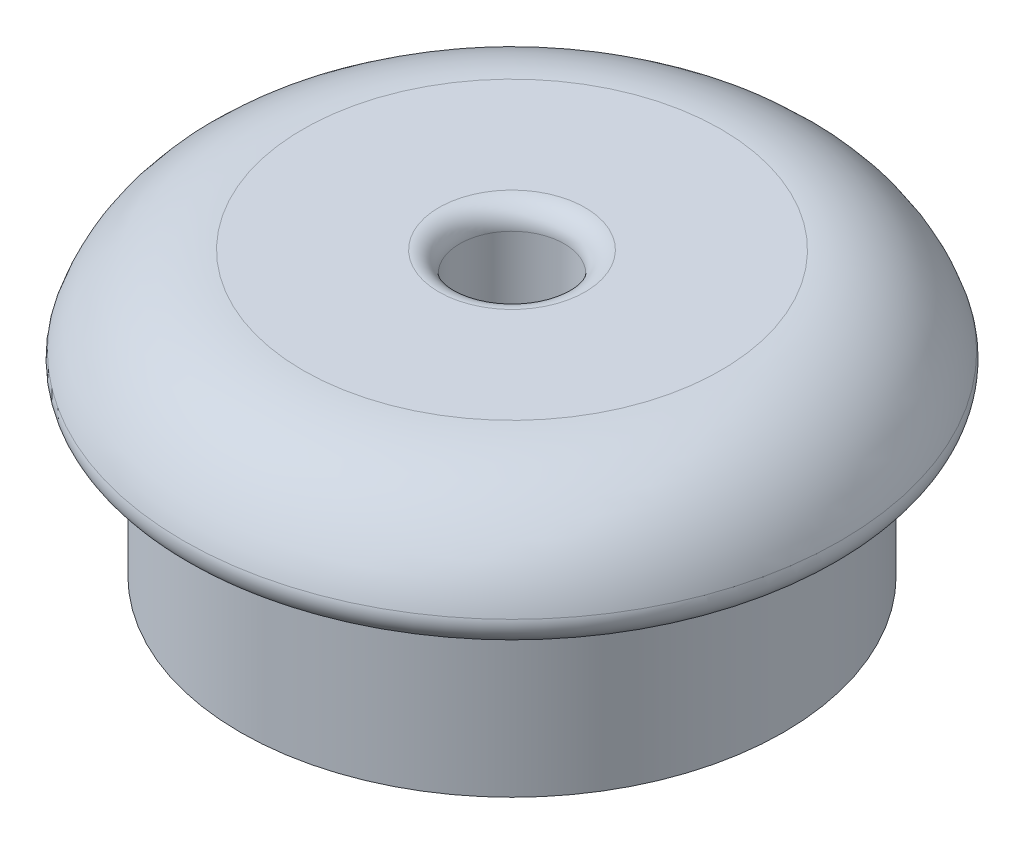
SolidWorks part; units mm, degrees
ref_plane "Plane1" through (0, 0, 0) normal (0, 0, 1) x (1, 0, 0)
ref_plane "Plane2" through (0, 0, 0) normal (0, 1, 0) x (1, 0, 0)
ref_plane "Plane3" through (0, 0, 0) normal (1, 0, 0) x (0, 0, -1)
sketch "Sketch1" plane through (0, 0, 0) normal (0, 0, 1) x (1, 0, 0)
  line L0 (0, 0) -> (0, 5.7189) construction
  line L1 (0, 0) -> (7.503, 0)
  line L3 (5.08, 2.794) -> (0, 2.794)
  line L4 (0, 2.794) -> (0, 0)
  arc A0 (7.503, 0) -> (7.9876, 0.6604) centre (7.503, 0.508) ccw
  arc A1 (7.9876, 0.6604) -> (5.08, 2.794) centre (5.08, -0.254) ccw
  dimension "D4" = 0.508
  dimension "D3" = 3.048
  dimension "D1" = 5.08
  dimension "D2" = 2.794
revolve "Button Top" add sketch "Sketch1" angle 360 about L0
sketch "Sketch2" plane through (0, 0, 0) normal (0, -1, 0) x (1, 0, 0)
  circle A0 centre (0, 0) radius 6.604
  dimension "D1" = 13.208
extrude "Shaft" add sketch "Sketch2" along normal blind 4.064
sketch "Sketch3" plane through (0, -4.064, 0) normal (0, -1, 0) x (1, 0, 0)
  circle A0 centre (0, 0) radius 5.334
  circle A1 centre (0, 0) radius 2.54
  dimension "D1" = 10.668
  dimension "D2" = 5.08
extrude "Shaft Groove" cut sketch "Sketch3" against normal up to surface (4.064 mm away)
sketch "Sketch4" plane through (0, 2.794, 0) normal (0, 1, 0) x (-1, 0, 0)
  circle A0 centre (0, 0) radius 1.27
  dimension "D1" = 2.54
extrude "Top Hole" cut sketch "Sketch4" against normal offset from surface (5.588 mm away) 1.27
fillet "Fillet1" radius 0.508 5 edges at (0, 0, -6.604) (0, 0, 2.54) (0, 0, 5.334) (0, 2.794, 1.27) (0, -2.794, -1.27)
